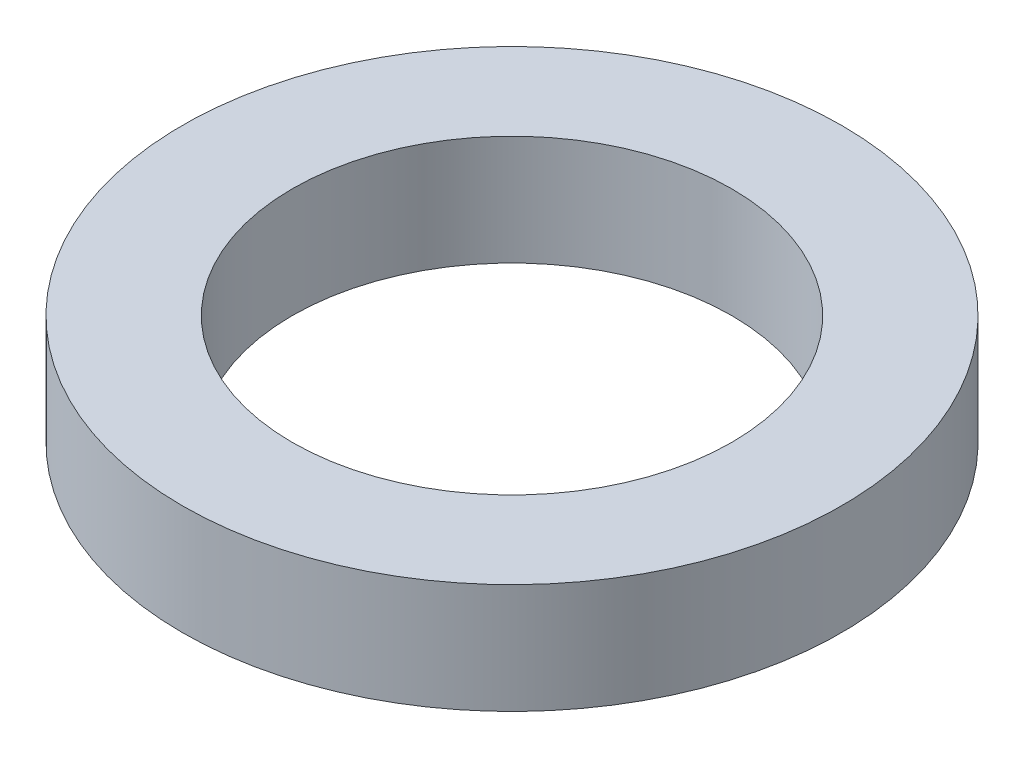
SolidWorks part; units mm, degrees
ref_plane "Спереди" through (0, 0, 0) normal (0, 0, 1) x (1, 0, 0)
ref_plane "Сверху" through (0, 0, 0) normal (0, 1, 0) x (1, 0, 0)
ref_plane "Справа" through (0, 0, 0) normal (1, 0, 0) x (0, 0, -1)
sketch "Эскиз1" plane through (0, 0, 0) normal (0, 1, 0) x (1, 0, 0)
  circle A0 centre (0, 0) radius 6
  circle A1 centre (0, 0) radius 4
extrude "Бобышка-Вытянуть1" add sketch "Эскиз1" along normal blind 2
